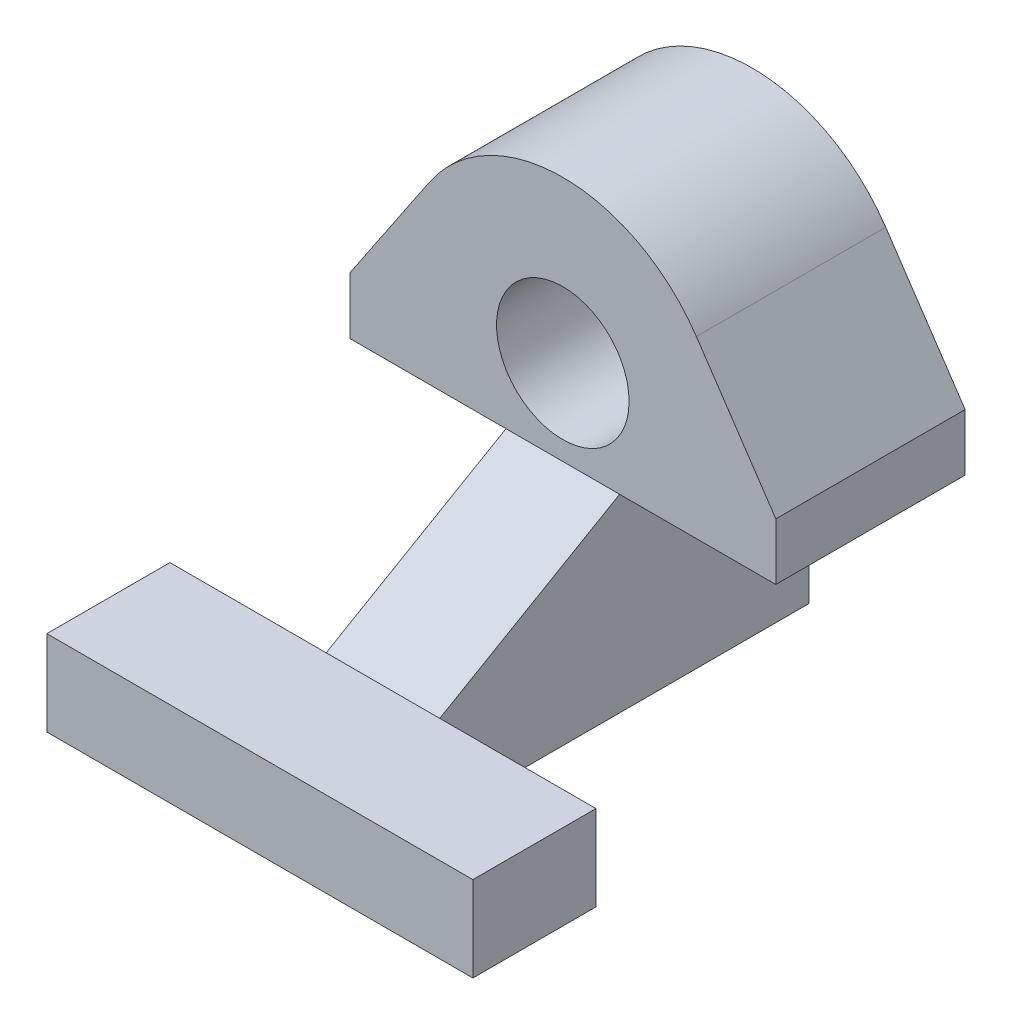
SolidWorks part; units mm, degrees
ref_plane "前视基准面" through (0, 0, 0) normal (0, 0, 1) x (1, 0, 0)
ref_plane "上视基准面" through (0, 0, 0) normal (0, 1, 0) x (1, 0, 0)
ref_plane "右视基准面" through (0, 0, 0) normal (1, 0, 0) x (0, 0, -1)
sketch "草图1" plane through (0, 0, 0) normal (0, 0, 1) x (1, 0, 0)
  line L0 (-22.5, -9) -> (22.5, -9)
  line L1 (0, 0) -> (0, -32.2308) construction
  line L2 (22.5, -9) -> (22.5, -3)
  line L3 (22.5, -3) -> (14.1089, 9.4836)
  line L4 (-22.5, -9) -> (-22.5, -3)
  line L5 (-22.5, -3) -> (-14.1089, 9.4836)
  circle A0 centre (0, 0) radius 7
  arc A1 (14.1089, 9.4836) -> (-14.1089, 9.4836) centre (0, 0) ccw
  dimension "D1" = 9
  dimension "D3" = 34
  dimension "D2" = 6
extrude "拉伸1" add sketch "草图1" along normal blind 20
sketch "草图2" plane through (0, 0, 0) normal (1, 0, 0) x (0, 0, -1)
  line L0 (0, -9) -> (0, -29)
  line L1 (-39, -29) -> (-39, -20)
  line L2 (-39, -20) -> (-20, -9)
  line L3 (-20, -9) -> (0, -9)
  line L4 (0, -29) -> (-39, -29)
  dimension "D1" = 20
  dimension "D2" = 39
  dimension "D3" = 9
extrude "拉伸2" add sketch "草图2" along normal mid plane 12
sketch "草图3" plane through (0, 0, 0) normal (1, 0, 0) x (0, 0, -1)
  line L0 (-39, -29) -> (0, -29) construction
  line L1 (-39, -20) -> (-52, -20)
  line L2 (-39, -20) -> (-39, -29)
  line L3 (-39, -29) -> (-52, -29)
  line L4 (-52, -20) -> (-52, -29)
extrude "拉伸3" add sketch "草图3" along normal mid plane 45
